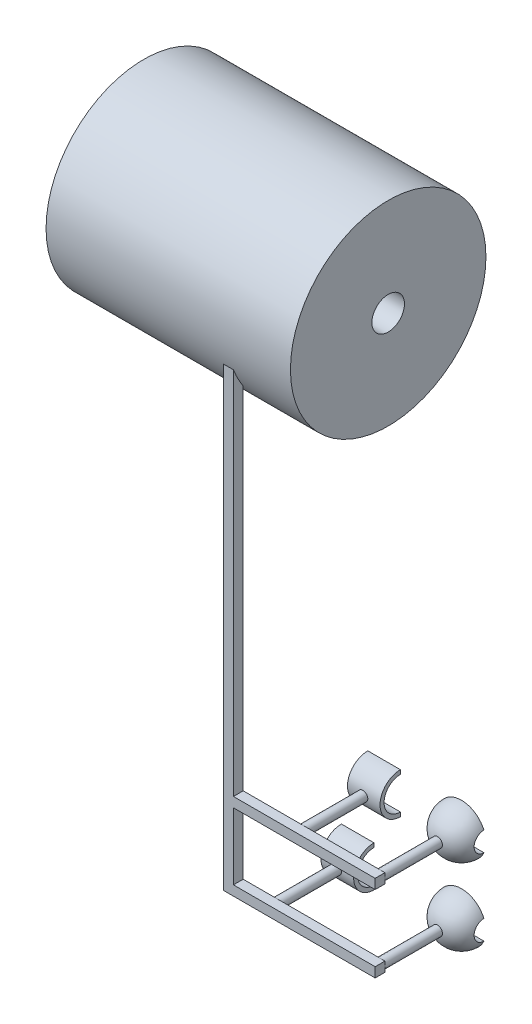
SolidWorks part; units mm, degrees
ref_plane "Plan de face" through (0, 0, 0) normal (0, 0, 1) x (1, 0, 0)
ref_plane "Plan de dessus" through (0, 0, 0) normal (0, 1, 0) x (1, 0, 0)
ref_plane "Plan de droite" through (0, 0, 0) normal (1, 0, 0) x (0, 0, -1)
sketch "Esquisse1" plane through (0, 0, 0) normal (0, 0, 1) x (1, 0, 0)
  line L0 (0, 10) -> (0, 15)
  line L1 (0, -10) -> (0, -15)
  arc A0 (0, 10) -> (0, -10) centre (0, 0) ccw
  arc A1 (0, 15) -> (0, -15) centre (0, 0) ccw
  dimension "D1" = 15
  dimension "D2" = 10
revolve "Révolution1" add sketch "Esquisse1" angle 180 about L0
sketch "Esquisse2" plane through (0, 0, 0) normal (0, 0, 1) x (1, 0, 0)
  line L0 (0, 0) -> (-90.9407, 0) construction
  line L1 (-47.5, 0) -> (-47.5, 64.2359) construction
  line L3 (-57.5, 12.5) -> (-37.5, 12.5)
  line L4 (-57.5, 12.5) -> (-57.5, 10)
  line L5 (-57.5, 10) -> (-37.5, 10)
  line L6 (-37.5, 12.5) -> (-37.5, 10)
  dimension "D1" = 47.5
  dimension "D2" = 20
  dimension "D3" = 25
  dimension "D4" = 20
revolve "Révolution3" add sketch "Esquisse2" angle 180 about L0
sketch "Esquisse3" plane through (0, 0, 0) normal (0, 0, 1) x (1, 0, 0)
  line L0 (0, 0) -> (0, -47) construction
  line L1 (0, -47) -> (-76.5408, -47) construction
  line L2 (0, -37) -> (0, -32)
  line L3 (0, -62) -> (0, -57)
  arc A0 (0, -57) -> (0, -37) centre (0, -47) ccw
  arc A1 (0, -62) -> (0, -32) centre (0, -47) ccw
  dimension "D2" = 10
  dimension "D3" = 15
  dimension "D1" = 47
revolve "Révolution4" add sketch "Esquisse3" angle 180 about L0
sketch "Esquisse4" plane through (0, 0, 0) normal (0, 0, 1) x (1, 0, 0)
  line L0 (0, -47) -> (-63.7, -47) construction
  line L1 (-63.7, -47) -> (-63.7, -19.1581) construction
  line L3 (-53.7, -34.5) -> (-73.7, -34.5)
  line L4 (-53.7, -34.5) -> (-53.7, -37)
  line L5 (-53.7, -37) -> (-73.7, -37)
  line L6 (-73.7, -34.5) -> (-73.7, -37)
  circle A0 centre (0, -47) radius 10 construction
  dimension "D1" = 63.7
  dimension "D2" = 20
  dimension "D3" = 25
  dimension "D4" = 20
revolve "Révolution5" add sketch "Esquisse4" angle 180 about L0
sketch "Esquisse5" plane through (0, 0, 0) normal (0, 0, 1) x (1, 0, 0)
  line L0 (0, 0) -> (0, 251.37) construction
  line L1 (0, 251.37) -> (-139.0568, 251.37) construction
  line L3 (-45, 251.37) -> (-195, 251.37)
  line L4 (-45, 251.37) -> (-45, 311.37)
  line L5 (-45, 311.37) -> (-195, 311.37)
  line L6 (-195, 251.37) -> (-195, 311.37)
  dimension "D1" = 251.37
  dimension "D2" = 45
  dimension "D3" = 150
  dimension "D4" = 120
revolve "Révolution6" add sketch "Esquisse5" angle 360 about L1
sketch "Esquisse6" plane through (-45, 0, 0) normal (1, 0, 0) x (0, 0, -1)
  circle A0 centre (0, 251.37) radius 10
  circle A1 centre (0, 251.37) radius 60 construction
  dimension "D1" = 20
extrude "Enlèv. mat.-Extru.1" cut sketch "Esquisse6" against normal blind 20
ref_plane "Plan1" through (0, 0, 50) normal (0, 0, 1) x (1, 0, 0)
sketch "Esquisse7" plane through (0, 0, 50) normal (0, 0, 1) x (1, 0, 0)
  line L0 (0, -47) -> (-63.7, -47) construction
  line L1 (0, 0) -> (-47.5, 0) construction
  circle A0 centre (0, 0) radius 3
  circle A1 centre (0, -47) radius 3
  circle A2 centre (-63.7, -47) radius 3
  circle A3 centre (-47.5, 0) radius 3
  circle A4 centre (0, -47) radius 15 construction
  dimension "D1" = 6
  dimension "D2" = 6
  dimension "D3" = 6
  dimension "D4" = 6
  dimension "D5" = 63.7
  dimension "D6" = 47.5
extrude "Extrusion2" add sketch "Esquisse7" against normal blind 37
sketch "Esquisse8" plane through (0, 0, 50) normal (0, 0, 1) x (1, 0, 0)
  line L0 (-84, 3) -> (-84, 251.37)
  line L1 (3, -3) -> (-84, -3)
  line L2 (3, -3) -> (3, 3)
  line L3 (3, 3) -> (-84, 3)
  line L4 (-65, 251.37) -> (-45, 251.37) construction
  line L5 (3, -50) -> (-90, -50)
  line L6 (3, -50) -> (3, -44)
  line L7 (3, -44) -> (-84, -44)
  line L10 (-84, -44) -> (-84, -3)
  line L11 (-84, 251.37) -> (-90, 251.37)
  line L12 (-90, -50) -> (-90, 251.37)
  circle A2 centre (0, 0) radius 3 construction
  circle A3 centre (-47.5, 0) radius 3 construction
  circle A4 centre (0, -47) radius 3 construction
  circle A5 centre (-63.7, -47) radius 3 construction
  dimension "D1" = 6
  dimension "D2" = 90
extrude "Extrusion3" add sketch "Esquisse8" along normal blind 6
sketch "Esquisse9" plane through (0, 0, 0) normal (1, 0, 0) x (0, 0, -1)
  line L0 (0, -62) -> (0, -32) construction
  circle A0 centre (0, 0) radius 6
  circle A1 centre (0, -47) radius 6
  dimension "D1" = 12
  dimension "D2" = 12
extrude "Enlèv. mat.-Extru.2" cut sketch "Esquisse9" against normal through all and the other way through all
